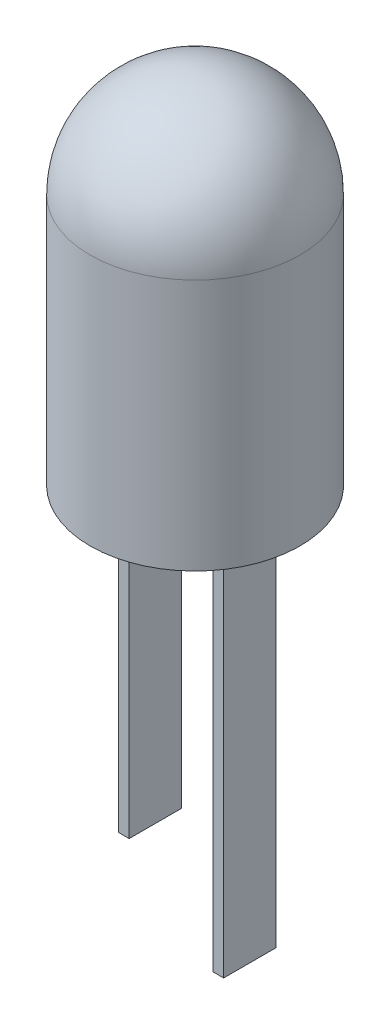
SolidWorks part; units mm, degrees
ref_plane "Front Plane" through (0, 0, 0) normal (0, 0, 1) x (1, 0, 0)
ref_plane "Top Plane" through (0, 0, 0) normal (0, 1, 0) x (1, 0, 0)
ref_plane "Right Plane" through (0, 0, 0) normal (1, 0, 0) x (0, 0, -1)
sketch "Sketch1" plane through (0, 0, 0) normal (0, 1, 0) x (1, 0, 0)
  circle A0 centre (0, 0) radius 10
extrude "Boss-Extrude2" add sketch "Sketch1" along normal blind 24
dome "Dome1" faces to dome 2 distance 10 parameters "D1"=10
sketch "Sketch6" plane through (0, 0, 0) normal (0, 1, 0) x (1, 0, 0)
  line L0 (0, 0) -> (0, -1.6842)
  line L1 (-5, -2.277) -> (-4, -2.277)
  line L2 (-5, -2.277) -> (-5, 2.723)
  line L3 (-5, 2.723) -> (-4, 2.723)
  line L4 (-4, -2.277) -> (-4, 2.723)
  line L5 (4, -2.277) -> (4.997, -2.277)
  line L6 (4, -2.277) -> (4, 2.723)
  line L7 (4, 2.723) -> (4.997, 2.723)
  line L8 (4.997, -2.277) -> (4.997, 2.723)
  dimension "D1" = 5
  dimension "D2" = 1
  dimension "D3" = 4
  dimension "D4" = 4
extrude "Boss-Extrude3" add sketch "Sketch6" against normal blind 30 contours L2 L3 L4 L1
sketch "Sketch8" plane through (0, 0, 0) normal (0, -1, 0) x (1, 0, 0)
  line L0 (4, 2.277) -> (5, 2.277)
  line L1 (4, -2.723) -> (5, -2.723)
  line L3 (5, -2.723) -> (4, -2.723)
  line L4 (5, -2.723) -> (5, 2.277)
  line L5 (5, 2.277) -> (4, 2.277)
  line L6 (4, -2.723) -> (4, 2.277)
  line L7 (5, -2.723) -> (4, -2.723)
  line L8 (5, -2.723) -> (5, 2.277)
  line L9 (5, 2.277) -> (4, 2.277)
  line L10 (4, -2.723) -> (4, 2.277)
extrude "Boss-Extrude4" add sketch "Sketch8" along normal blind 37 contours L6 L1 L4 L0
